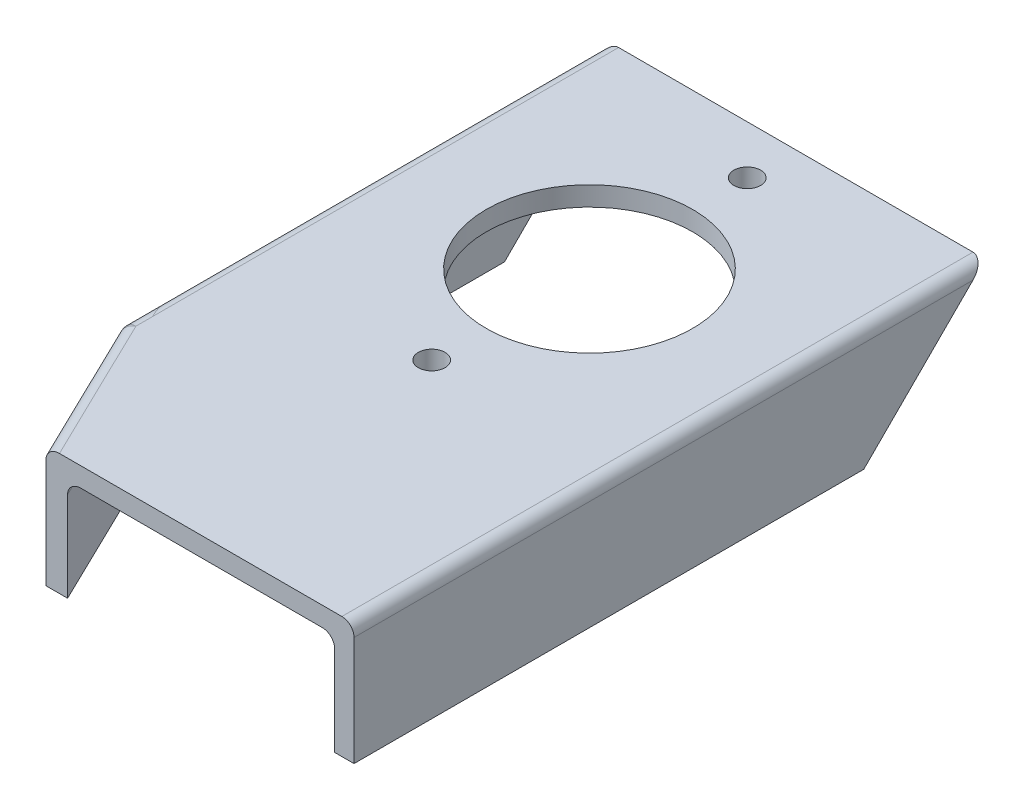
SolidWorks part; units mm, degrees
ref_plane "前视基准面" through (0, 0, 0) normal (0, 0, 1) x (1, 0, 0)
ref_plane "上视基准面" through (0, 0, 0) normal (0, 1, 0) x (1, 0, 0)
ref_plane "右视基准面" through (0, 0, 0) normal (1, 0, 0) x (0, 0, -1)
sketch "草图1" plane through (0, 0, 0) normal (0, 0, 1) x (1, 0, 0)
  line L0 (0, 82.0527) -> (0, -69.4292) construction
  line L1 (-78, 0) -> (78, 0)
  line L2 (78, 0) -> (78, -50)
  line L3 (78, -50) -> (70, -50)
  line L4 (70, -50) -> (70, -8)
  line L5 (70, -8) -> (-70, -8)
  line L6 (-70, -8) -> (-70, -50)
  line L7 (-70, -50) -> (-78, -50)
  line L8 (-78, -50) -> (-78, 0)
  dimension "D1" = 140
  dimension "D2" = 50
  dimension "D3" = 50
  dimension "D4" = 8
  dimension "D5" = 8
  dimension "D6" = 8
  dimension "D7" = 70
extrude "拉伸1" add sketch "草图1" along normal blind 320
sketch "草图2" plane through (0, 0, 0) normal (0, 1, 0) x (-1, 0, 0)
  line L0 (0, 339.6173) -> (0, -51.2166) construction
  line L1 (-78, 320) -> (78, 320) construction
  circle A0 centre (0, 85) radius 42.5
  circle A1 centre (0, 150) radius 5.5
  circle A2 centre (0, 20) radius 5.5
  dimension "D2" = 130
  dimension "D3" = 65
  dimension "D4" = 11
  dimension "D5" = 85
  dimension "D6" = 11
  dimension "D1" = 170
extrude "切除-拉伸1" cut sketch "草图2" against normal blind 320
sketch "草图3" plane through (78, 0, 0) normal (1, 0, 0) x (0, 0, -1)
  line L0 (-50, -50) -> (0, -50)
  line L1 (-320, -50) -> (0, -50) construction
  line L2 (0, -50) -> (0, 0)
  line L3 (0, 0) -> (-50, -50)
  dimension "D1" = 50
extrude "切除-拉伸2" cut sketch "草图3" against normal through all
fillet "圆角1" radius 5 4 edges at (-70, -8, 164) (-78, 0, 160) (70, -8, 164) (78, 0, 160)
sketch "草图4" plane through (0, 0, 0) normal (0, 1, 0) x (-1, 0, 0)
  line L0 (-73, 320) -> (73, 320) construction
  line L1 (28, 320) -> (40, 320)
  line L2 (28, 320) -> (28, 260)
  line L3 (28, 260) -> (40, 260)
  line L4 (40, 320) -> (40, 260)
  line L5 (78, 320) -> (78, 5) construction
  dimension "D1" = 38
  dimension "D2" = 12
  dimension "D3" = 60
extrude "切除-拉伸3" cut sketch "草图4" against normal blind 10
chamfer "倒角1" distance 10 angle 45 1 edges at (-28, -4, 320)
sketch "草图5" plane through (0, 0, 0) normal (0, 1, 0) x (-1, 0, 0)
  line L0 (28, 260) -> (40, 260) construction
  line L1 (-133.7528, 349.1685) -> (112.1798, 349.1685)
  line L2 (-133.7528, 349.1685) -> (-133.7528, 260)
  line L3 (-133.7528, 260) -> (112.1798, 260)
  line L4 (112.1798, 349.1685) -> (112.1798, 260)
extrude "切除-拉伸4" cut sketch "草图5" against normal through all
sketch "草图6" plane through (0, -50, 0) normal (0, -1, 0) x (1, 0, 0)
  line L0 (-40, 260) -> (-78, 181.6717)
  line L1 (65, 260) -> (-65, 260) construction
  line L2 (-78, 260) -> (-78, 50) construction
  line L3 (-78, 181.6717) -> (-78, 200)
  line L4 (-78, 200) -> (-48.8917, 260)
  line L5 (-48.8917, 260) -> (-40, 260)
  line L6 (-70, 260) -> (-78, 260) construction
  dimension "D1" = 38
  dimension "D2" = 8
  dimension "D3" = 60
extrude "拉伸2" add sketch "草图6" against normal up to surface (50 mm away)
sketch "草图7" plane through (0, -50, 0) normal (0, -1, 0) x (1, 0, 0)
  line L0 (-48.8917, 260) -> (-78, 200)
  line L1 (-78, 200) -> (-78, 260)
  line L2 (-78, 260) -> (-48.8917, 260)
extrude "拉伸3" cut sketch "草图7" against normal through all
sketch "草图9" plane through (-134.4839, 0, 65.2432) normal (0.8997, 0, -0.4365) x (-0.4365, 0, -0.8997)
  line L2 (-129.4065, 0) -> (-140.8616, 0)
  line L3 (-129.4065, -5) -> (-129.4065, 0)
  line L4 (-129.4065, 0) -> (-140.8616, 0)
  line L5 (-129.4065, -5) -> (-129.4065, 0)
  ellipse E1 centre (-140.8616, -5) end of major axis (-129.4065, -5) minor radius 5 (-129.4065, -5) -> (-140.8616, 0) ccw
  ellipse E2 centre (-140.8616, -5) end of major axis (-129.4065, -5) minor radius 5 (-129.4065, -5) -> (-140.8616, 0) ccw
  dimension "D1" = 0
extrude "拉伸4" cut sketch "草图9" against normal through all
fillet "圆角2" radius 5 6 edges at (-70, -31.5, 198.1619) (-68.5355, -9.4645, 201.1806) (-78, 0, 197.2019) (-52.5, -8, 234.2341) (-78, -25, 200) (-63.4459, 0, 230)
